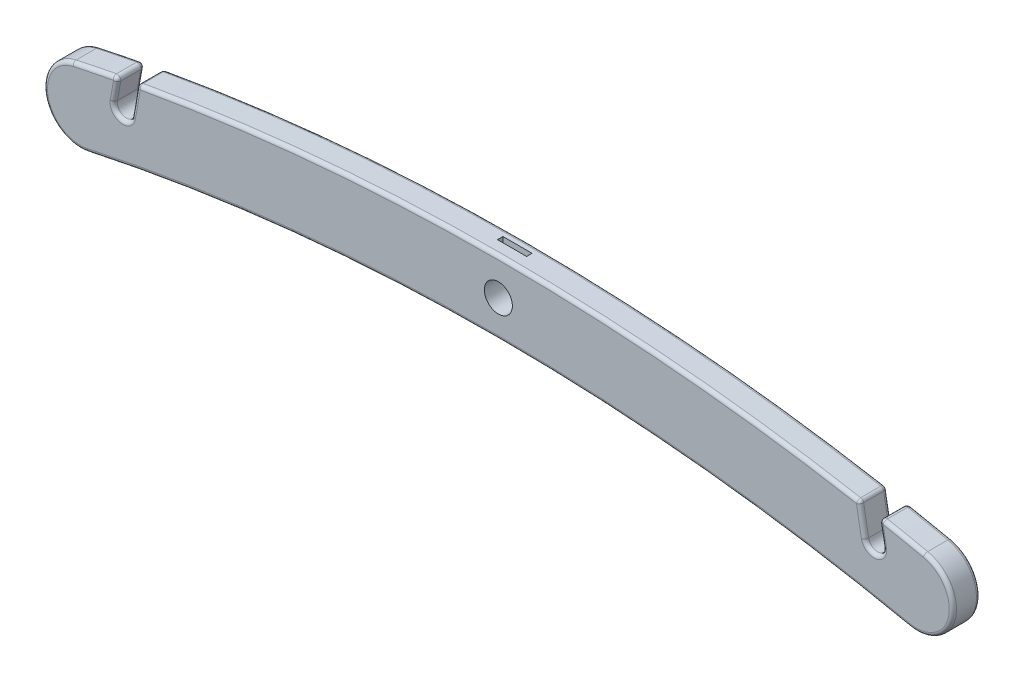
SolidWorks part; units mm, degrees
ref_plane "Front Plane" through (0, 0, 0) normal (0, 0, 1) x (1, 0, 0)
ref_plane "Top Plane" through (0, 0, 0) normal (0, 1, 0) x (1, 0, 0)
ref_plane "Right Plane" through (0, 0, 0) normal (1, 0, 0) x (0, 0, -1)
imported_body "Stock-Final Toy Scales-1"
other "Move Face1" parameters "D1"=0.2
